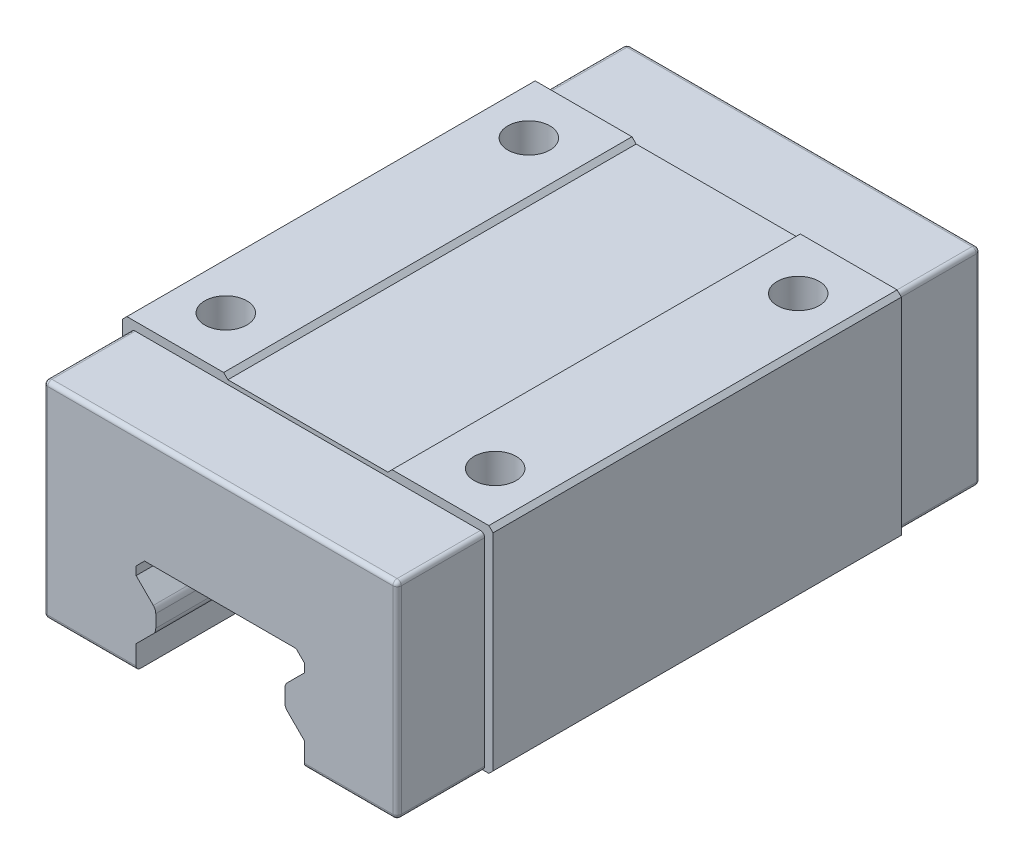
SolidWorks part; units mm, degrees
ref_plane "Front Plane" through (0, 0, 0) normal (0, 0, 1) x (1, 0, 0)
ref_plane "Top Plane" through (0, 0, 0) normal (0, 1, 0) x (1, 0, 0)
ref_plane "Right Plane" through (0, 0, 0) normal (1, 0, 0) x (0, 0, -1)
sketch "Sketch1" plane through (0, 0, 0) normal (0, 0, 1) x (1, 0, 0)
  line L1 (-22, 4.5) -> (22, 4.5)
  line L2 (-22, 4.5) -> (-22, 30)
  line L3 (-22, 30) -> (22, 30)
  line L4 (22, 4.5) -> (22, 30)
  line L5 (-22, 4.5) -> (22, 30) construction
  line L6 (-22, 30) -> (22, 4.5) construction
  point P0 (0, 17.25)
  dimension "D1" = 30
  dimension "D2" = 4.5
  dimension "D3" = 44
extrude "Boss-Extrude1" add sketch "Sketch1" along normal mid plane 48.5
sketch "Sketch2" plane through (0, 0, 0) normal (0, 0, 1) x (1, 0, 0)
  line L0 (-22, 4.5) -> (22, 4.5) construction
  line L1 (-21, 4.5) -> (21, 4.5)
  line L2 (-21, 4.5) -> (-21, 29)
  line L3 (-21, 29) -> (21, 29)
  line L4 (21, 4.5) -> (21, 29)
  line L5 (-21, 29) -> (-22, 29) construction
  line L6 (-22, 30) -> (-22, 4.5) construction
  line L7 (21, 29) -> (21, 30) construction
  line L8 (22, 30) -> (-22, 30) construction
  line L9 (21, 29) -> (22, 29) construction
  line L10 (22, 4.5) -> (22, 30) construction
  point P9 (0, 29)
  dimension "D1" = 1
extrude "Boss-Extrude2" add sketch "Sketch2" along normal mid plane 69.3
sketch "Sketch3" plane through (0, 0, 34.65) normal (0, 0, 1) x (1, 0, 0)
  line L1 (-10, 16.3) -> (10, 16.3)
  line L2 (-10, 16.3) -> (-10, 0)
  line L3 (-10, 0) -> (10, 0)
  line L4 (10, 16.3) -> (10, 0)
  line L5 (-10, 16.3) -> (10, 0) construction
  line L6 (-10, 0) -> (10, 16.3) construction
  point P0 (0, 8.15)
  dimension "D1" = 20
  dimension "D2" = 16.3
extrude "Cut-Extrude1" cut sketch "Sketch3" against normal through all
sketch "Sketch4" plane through (0, 0, 34.65) normal (0, 0, 1) x (1, 0, 0)
  line L0 (-10, 14.3) -> (-10, 7.3)
  line L1 (-10, 16.3) -> (-10, 4.5) construction
  line L2 (-10, 7.3) -> (-7.6667, 9.6333)
  line L3 (-7.6667, 9.6333) -> (-7.6667, 11.9667)
  line L4 (-7.6667, 11.9667) -> (-10, 14.3)
  line L5 (10, 16.3) -> (-10, 16.3) construction
  line L6 (-7.6667, 11.9667) -> (-10, 11.9667) construction
  line L7 (-7.6667, 9.6333) -> (-10, 9.6333) construction
  line L8 (-8.8333, 11.9667) -> (-8.8333, 9.6333) construction
  line L9 (0, 0) -> (0, 16.3) construction
  line L10 (8.8333, 11.9667) -> (8.8333, 9.6333) construction
  line L11 (7.6667, 9.6333) -> (10, 9.6333) construction
  line L12 (7.6667, 11.9667) -> (10, 11.9667) construction
  line L13 (7.6667, 11.9667) -> (10, 14.3)
  line L14 (7.6667, 9.6333) -> (7.6667, 11.9667)
  line L15 (10, 7.3) -> (7.6667, 9.6333)
  line L16 (10, 14.3) -> (10, 7.3)
extrude "Boss-Extrude3" add sketch "Sketch4" against normal up to surface (69.3 mm away)
chamfer "Chamfer1" distance 1 angle 45 2 edges at (10, 16.3, 0) (-10, 16.3, 0)
fillet "Fillet1" radius 1 4 edges at (7.6667, 9.6333, 0) (7.6667, 11.9667, 0) (-7.6667, 9.6333, 0) (-7.6667, 11.9667, 0)
sketch "Sketch5" plane through (0, 0, 24.25) normal (0, 0, 1) x (1, 0, 0)
  line L0 (22, 30) -> (-22, 30) construction
  line L1 (-10, 30) -> (10, 30)
  line L2 (-10, 30) -> (-10, 29.5)
  line L3 (-10, 29.5) -> (10, 29.5)
  line L4 (10, 30) -> (10, 29.5)
  point P6 (0, 29.5)
  dimension "D1" = 20
  dimension "D2" = 0.5
extrude "Cut-Extrude2" cut sketch "Sketch5" against normal through all
chamfer "Chamfer2" distance 0.5 angle 45 6 edges at (22, 30, 0) (22, 4.5, 0) (-22, 4.5, 0) (-22, 30, 0) (10, 29.5, 0) (-10, 29.5, 0)
fillet "Fillet2" radius 0.5 18 edges at (-21, 4.5, -29.45) (15.5, 4.5, -34.65) (-21, 4.5, 29.45) (-15.5, 4.5, -34.65) (-15.5, 4.5, 34.65) (15.5, 4.5, 34.65) (21, 4.5, 29.45) (-21, 16.75, 34.65) (-21, 16.75, -34.65) (-21, 29, 29.45) (21, 29, 29.45) (21, 16.75, 34.65) (21, 16.75, -34.65) (0, 29, 34.65) (0, 29, -34.65) (21, 4.5, -29.45) (21, 29, -29.45) (-21, 29, -29.45)
sketch "Sketch6" plane through (0, 30, 0) normal (0, 1, 0) x (1, 0, 0)
  line L0 (-16, 18) -> (0, 0) construction
  line L1 (0, 0) -> (16, -18) construction
  line L2 (16, 18) -> (0, 0) construction
  line L3 (0, 0) -> (-16, -18) construction
  circle A0 centre (-16, 18) radius 2.5
  circle A1 centre (-16, -18) radius 2.5
  circle A2 centre (16, -18) radius 2.5
  circle A3 centre (16, 18) radius 2.5
  dimension "D1" = 5
  dimension "D2" = 32
  dimension "D3" = 36
extrude "Cut-Extrude3" cut sketch "Sketch6" against normal blind 7.5
sketch "Sketch7" plane through (0, 0, 0) normal (0, 0, 1) x (1, 0, 0)
  line L0 (-21.5, 30) -> (-31.5, 30)
  line L1 (-31.5, 30) -> (-31.5, 21)
  line L2 (-21.5, 30) -> (-21.5, 12)
  line L3 (-22, 29.5) -> (-22, 5) construction
  line L4 (-22, 12) -> (-21.5, 12)
  line L5 (-31.5, 21) -> (-31, 21)
  line L6 (0, 0) -> (0, 29.5) construction
  line L7 (-9.5, 29.5) -> (9.5, 29.5) construction
  line L8 (31.5, 21) -> (31, 21)
  line L9 (22, 12) -> (21.5, 12)
  line L10 (21.5, 30) -> (21.5, 12)
  line L11 (31.5, 30) -> (31.5, 21)
  line L12 (21.5, 30) -> (31.5, 30)
  arc A1 (-31, 21) -> (-22, 12) centre (-31, 12) cw
  arc A2 (31, 21) -> (22, 12) centre (31, 12) ccw
  point P22 (-31.25, 21)
  dimension "D1" = 63
  dimension "D2" = 9
  dimension "D3" = 0.5
extrude "Boss-Extrude4" [suppressed] add sketch "Sketch7" along normal mid plane 30
sketch "Sketch8" [suppressed] plane through (0, 0, 0) normal (0, 0, 1) x (1, 0, 0)
  line L5 (-35, 30) -> (-35, 40)
  line L6 (-35, 30) -> (-23.38, 30)
  line L7 (-35, 40) -> (-23.38, 40)
  line L8 (-23.38, 30) -> (-23.38, 40)
  line L9 (35, 30) -> (35, 40)
  line L10 (35, 30) -> (23.38, 30)
  line L11 (35, 40) -> (23.38, 40)
  line L13 (23.38, 40) -> (23.38, 30)
extrude "Boss-Extrude5" [suppressed] add sketch "Sketch8" along normal mid plane 48.5
chamfer "Chamfer3" [suppressed] distance 0.5 angle 45
fillet "Fillet3" [suppressed] radius 5
equation "\"D2@Sketch4\"=\"D1@Sketch4\"*3.5"
